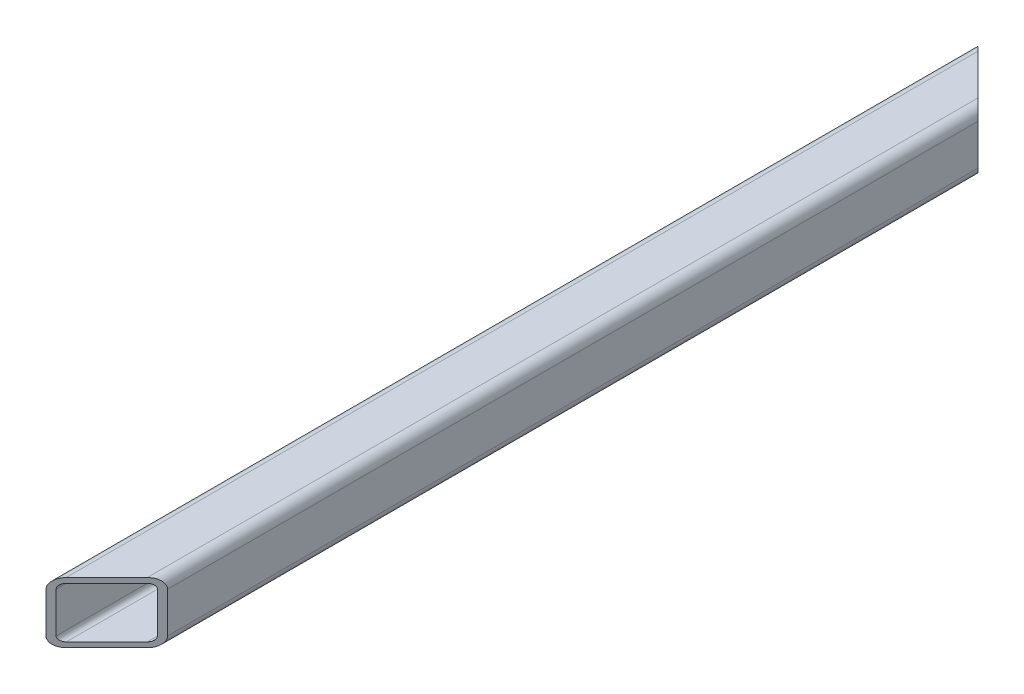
SolidWorks part; units mm, degrees
ref_plane "Plane1" through (0, 0, 0) normal (0, 0, 1) x (1, 0, 0)
ref_plane "Plane2" through (0, 0, 0) normal (0, 1, 0) x (1, 0, 0)
ref_plane "Plane3" through (0, 0, 0) normal (1, 0, 0) x (0, 0, -1)
sketch "Sketch1" plane through (0, 0, 0) normal (0, 0, 1) x (1, 0, 0)
  line L0 (-20, -25) -> (20, -25)
  line L1 (-25, -20) -> (-25, 20)
  line L2 (20, 25) -> (-20, 25)
  line L3 (25, 20) -> (25, -20)
  line L4 (-20, -30) -> (20, -30)
  line L5 (-30, -20) -> (-30, 20)
  line L6 (20, 30) -> (-20, 30)
  line L7 (30, 20) -> (30, -20)
  line L8 (-30, 0) -> (-25, 0) construction
  line L9 (-25, 0) -> (25, 0) construction
  line L10 (25, 0) -> (30, 0) construction
  line L12 (0, 30) -> (0, 25) construction
  line L13 (0, 25) -> (0, -25) construction
  line L14 (0, -25) -> (0, -30) construction
  arc A0 (30, 20) -> (20, 30) centre (20, 20) ccw
  arc A1 (20, -30) -> (30, -20) centre (20, -20) ccw
  arc A2 (-30, -20) -> (-20, -30) centre (-20, -20) ccw
  arc A3 (-20, 30) -> (-30, 20) centre (-20, 20) ccw
  arc A4 (-20, 25) -> (-25, 20) centre (-20, 20) ccw
  arc A5 (25, 20) -> (20, 25) centre (20, 20) ccw
  arc A6 (20, -25) -> (25, -20) centre (20, -20) ccw
  arc A7 (-25, -20) -> (-20, -25) centre (-20, -20) ccw
  point P2 (-30, 30)
  point P33 (-30, -30)
  point P34 (30, -30)
  point P36 (30, 30)
extrude "Extrusion1" add sketch "Sketch1" along normal blind 920
sketch "Esquisse3" plane through (0, 30, 0) normal (0, 1, 0) x (1, 0, 0)
  line L0 (30, -920) -> (-30, -920)
  line L1 (-30, -920) -> (30, -860)
  line L2 (30, -860) -> (30, -920)
  line L5 (-30, -920) -> (-30, 0) construction
  line L6 (20, -920) -> (-20, -920) construction
  dimension "D1" = 60
  dimension "D2" = 60
  dimension "D3" = 0
  dimension "D4" = 0
extrude "Extrusion3" cut sketch "Esquisse3" against normal through all
sketch "Esquisse4" plane through (0, 30, 0) normal (0, 1, 0) x (1, 0, 0)
  line L0 (-30, 0) -> (30, -60)
  line L1 (30, -60) -> (30, 0)
  line L2 (30, 0) -> (-30, 0)
  line L3 (30, -860) -> (30, 0) construction
  line L4 (20, 0) -> (-20, 0) construction
  dimension "D1" = 60
  dimension "D2" = 60
  dimension "D3" = 0
  dimension "D4" = 0
extrude "Extrusion4" cut sketch "Esquisse4" against normal through all
